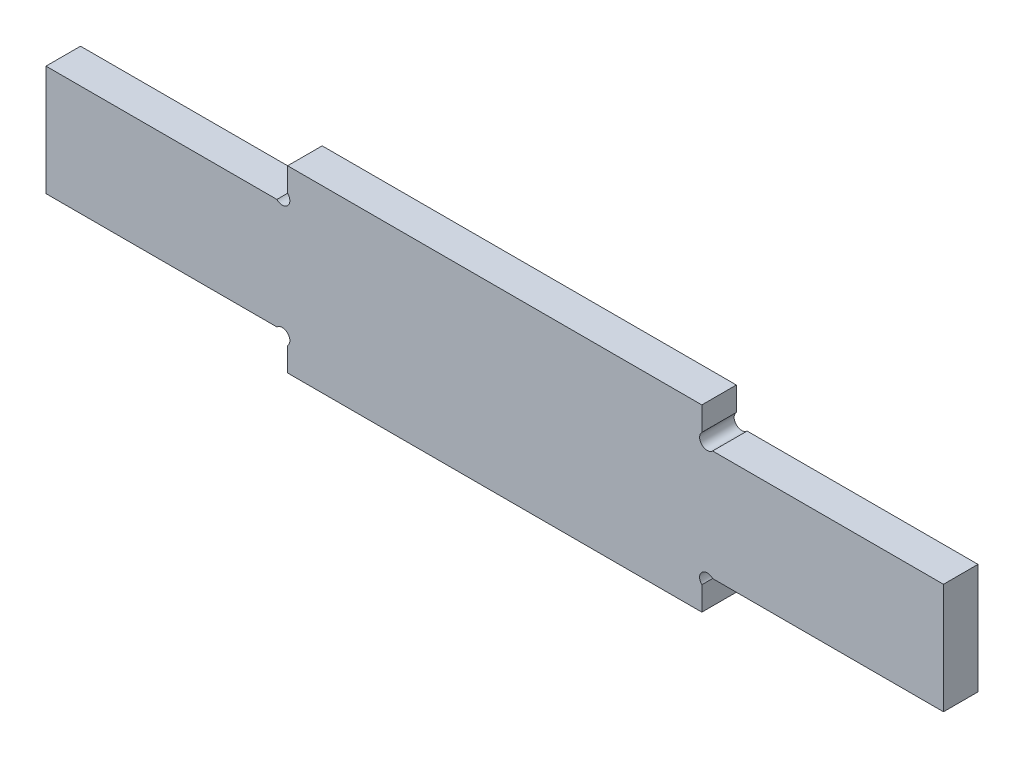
SolidWorks part; units mm, degrees
ref_plane "Plan de face" through (0, 0, 0) normal (0, 0, 1) x (1, 0, 0)
ref_plane "Plan de dessus" through (0, 0, 0) normal (0, 1, 0) x (1, 0, 0)
ref_plane "Plan de droite" through (0, 0, 0) normal (1, 0, 0) x (0, 0, -1)
sketch "Esquisse1" plane through (0, 0, 0) normal (0, 0, 1) x (1, 0, 0)
  line L1 (0, 0) -> (65, 0)
  line L2 (0, 0) -> (0, 26)
  line L3 (0, 26) -> (65, 26)
  line L4 (65, 0) -> (65, 26)
  dimension "D1" = 26
  dimension "D2" = 65
extrude "Boss.-Extru.1" add sketch "Esquisse1" along normal blind 5
sketch "Esquisse2" plane through (0, 0, 5) normal (0, 0, 1) x (1, 0, 0)
  line L1 (0, 26) -> (35, 26)
  line L2 (0, 26) -> (0, 21)
  line L3 (0, 21) -> (35, 21)
  line L4 (35, 26) -> (35, 21)
  line L5 (0, 0) -> (35, 0)
  line L6 (0, 0) -> (0, 5)
  line L7 (0, 5) -> (35, 5)
  line L8 (35, 0) -> (35, 5)
  dimension "D1" = 5
  dimension "D2" = 5
  dimension "D3" = 35
  dimension "D4" = 35
extrude "Enlèv. mat.-Extru.1" cut sketch "Esquisse2" against normal up to next
sketch "Esquisse3" plane through (0, 0, 5) normal (0, 0, 1) x (1, 0, 0)
  line L0 (35, 21) -> (23.0687, 32.9313) construction
  line L1 (35, 5) -> (25.3186, -4.6814) construction
  line L2 (0, 21) -> (35, 21) construction
  line L3 (35, 5) -> (0, 5) construction
  circle A0 centre (34.2222, 21.7778) radius 1.1
  circle A1 centre (34.2222, 4.2222) radius 1.1
  dimension "D3" = 2.2
  dimension "D4" = 2.2
  dimension "D1" = 45
  dimension "D2" = 45
extrude "Enlèv. mat.-Extru.2" cut sketch "Esquisse3" against normal up to next
mirror "Symétrie1" about plane through (65, 0, 5) normal (-1, 0, 0) of "Boss.-Extru.1", "Enlèv. mat.-Extru.1", "Enlèv. mat.-Extru.2"
